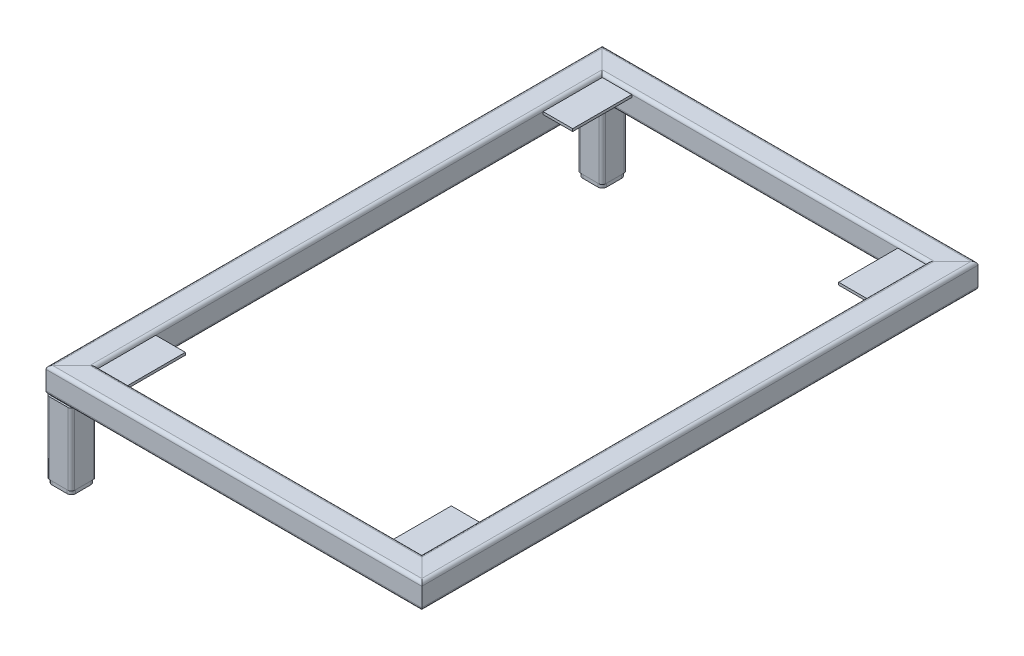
SolidWorks part; units mm, degrees
ref_plane "Plan de face" through (0, 0, 0) normal (0, 0, 1) x (1, 0, 0)
ref_plane "Plan de dessus" through (0, 0, 0) normal (0, 1, 0) x (1, 0, 0)
ref_plane "Plan de droite" through (0, 0, 0) normal (1, 0, 0) x (0, 0, -1)
sketch3d "Esquisse3D2"
  line L2 (-7.8466, -369.5842, 131.2649) -> (-7.8466, -369.5842, 760)
  line L4 (407.1534, -369.5842, 760) -> (407.1534, -369.5842, 131.2649)
  line L5 (-7.8466, -369.5842, 131.2649) -> (-7.8466, -469.5842, 131.2649)
  line L15 (407.1534, -369.5842, 760) -> (-7.8466, -369.5842, 760)
  line L17 (-7.8466, -369.5842, 131.2649) -> (407.1534, -369.5842, 131.2649)
  line L18 (-7.8466, -369.5842, 760) -> (-7.8466, -469.5842, 760)
  dimension "D2" = 415
  dimension "D4" = 415
  dimension "D5" = 100
  dimension "D10" = 100
other "Elément mécano-soudé1"
ref_plane "Plan1" through (407.1534, -369.5842, 760) normal (0, 0, -1) x (1, 0, 0)
sketch "Sketch1" plane through (407.1534, -369.5842, 760) normal (0, 0, -1) x (1, 0, 0)
  line L0 (-11, -13) -> (11, -13)
  line L1 (-13, -11) -> (-13, 11)
  line L2 (11, 13) -> (-11, 13)
  line L3 (13, 11) -> (13, -11)
  line L4 (-11, -15) -> (11, -15)
  line L5 (-15, -11) -> (-15, 11)
  line L6 (11, 15) -> (-11, 15)
  line L7 (15, 11) -> (15, -11)
  line L8 (-15, 0) -> (-13, 0) construction
  line L9 (-13, 0) -> (13, 0) construction
  line L10 (13, 0) -> (15, 0) construction
  line L12 (0, 15) -> (0, 13) construction
  line L13 (0, 13) -> (0, -13) construction
  line L14 (0, -13) -> (0, -15) construction
  arc A0 (15, 11) -> (11, 15) centre (11, 11) ccw
  arc A1 (11, -15) -> (15, -11) centre (11, -11) ccw
  arc A2 (-15, -11) -> (-11, -15) centre (-11, -11) ccw
  arc A3 (-11, 15) -> (-15, 11) centre (-11, 11) ccw
  arc A4 (-11, 13) -> (-13, 11) centre (-11, 11) ccw
  arc A5 (13, 11) -> (11, 13) centre (11, 11) ccw
  arc A6 (11, -13) -> (13, -11) centre (11, -11) ccw
  arc A7 (-13, -11) -> (-11, -13) centre (-11, -11) ccw
  point P2 (-15, 15)
  point P33 (-15, -15)
  point P34 (15, -15)
  point P36 (15, 15)
  point P37 (0, 0)
  dimension "D1" = 4
  dimension "Thickness" = 2
  dimension "V_leg" = 30
  dimension "H_leg" = 30
other "Embout1" parameters "D1"=5, "D2"=3, "D3"=3
fillet "Congé1" radius 5 4 edges at (6.1534, -472.0842, 746) (-21.8466, -472.0842, 746) (-21.8466, -472.0842, 774) (6.1534, -472.0842, 774)
fillet "Congé2" radius 5 4 edges at (6.1534, -472.0842, 117.2649) (-21.8466, -472.0842, 117.2649) (-21.8466, -472.0842, 145.2649) (6.1534, -472.0842, 145.2649)
sketch "Esquisse1" plane through (0, -474.5842, 0) normal (0, -1, 0) x (1, 0, 0)
  line L0 (1.1534, 145.2649) -> (-16.8466, 145.2649) construction
  line L1 (-21.8466, 140.2649) -> (-21.8466, 122.2649) construction
  line L2 (1.1534, 774) -> (-16.8466, 774) construction
  line L3 (-21.8466, 769) -> (-21.8466, 751) construction
  point P0 (-8.1466, 760.3)
  point P1 (-8.1466, 131.5649)
  dimension "D1" = 13.7
  dimension "D2" = 13.7
  dimension "D3" = 13.7
  dimension "D4" = 13.7
hole_wizard "Dégagement 1" positions "Esquisse3D3" profile "Esquisse2" hole size "M12" standard "ISO"
sketch3d "Esquisse3D3"
  point P0 (-8.1466, -474.5842, 760.3)
  point P3 (-8.1466, -474.5842, 131.5649)
sketch "Esquisse2" plane through (-8.1466, -474.5842, 760.3) normal (1, 0, 0) x (0, 0, -1)
  line L0 (0, 0) -> (0, 14.0558)
  line L1 (0, 14.0558) -> (6.75, 10)
  line L2 (6.75, 10) -> (6.75, 0)
  line L5 (6.75, 0) -> (0, 0)
  line L10 (0, 14.0558) -> (-6.75, 10) construction
  line L11 (0, -6.35) -> (0, 107.95) construction
  dimension "Diamètre du perçage" = 13.5
  dimension "Profondeur du perçage" = 10
  dimension "Angle de pointe" = 118
sketch "Esquisse3" plane through (0, 0, 146.2649) normal (0, 0, 1) x (1, 0, 0)
  line L1 (392.1534, -358.5842) -> (357.1534, -358.5842)
  line L2 (392.1534, -358.5842) -> (392.1534, -361.5842)
  line L3 (392.1534, -361.5842) -> (357.1534, -361.5842)
  line L4 (357.1534, -358.5842) -> (357.1534, -361.5842)
  dimension "D1" = 3
  dimension "D2" = 35
extrude "Extrusion1" add sketch "Esquisse3" along normal blind 70 separate body
sketch "Esquisse4" plane through (0, 0, 745) normal (0, 0, -1) x (-1, 0, 0)
  line L1 (-392.1534, -358.5842) -> (-357.1534, -358.5842)
  line L2 (-392.1534, -358.5842) -> (-392.1534, -361.5842)
  line L3 (-392.1534, -361.5842) -> (-357.1534, -361.5842)
  line L4 (-357.1534, -358.5842) -> (-357.1534, -361.5842)
  dimension "D1" = 3
  dimension "D2" = 35
extrude "Extrusion2" add sketch "Esquisse4" along normal blind 70 separate body
sketch "Esquisse5" [suppressed] plane through (0, -359.7842, 0) normal (0, 1, 0) x (-1, 0, 0)
  line L0 (-392.1534, 216.2649) -> (-357.1534, 216.2649) construction
  line L1 (-392.1534, 216.2649) -> (-392.1534, 146.2649) construction
  line L2 (-357.1534, 675) -> (-392.1534, 675) construction
  point P0 (-371.6534, 197.2649)
  point P5 (-371.6534, 694)
  dimension "D1" = 19
  dimension "D2" = 20.5
  dimension "D3" = 19
hole_wizard "Dégagement M102" positions "Esquisse3D4" profile "Esquisse6" hole size "M10" standard "ISO"
sketch3d "Esquisse3D4" [suppressed]
  point P0 (371.6534, -359.7842, 197.2649)
  point P3 (371.6534, -359.7842, 694)
sketch "Esquisse6" plane through (371.6534, -359.7842, 197.2649) normal (1, 0, 0) x (0, 0, 1)
  line L0 (0, 0) -> (0, 13.3047)
  line L1 (0, 13.3047) -> (5.5, 10)
  line L2 (5.5, 10) -> (5.5, 0)
  line L5 (5.5, 0) -> (0, 0)
  line L10 (0, 13.3047) -> (-5.5, 10) construction
  line L11 (0, -6.35) -> (0, 107.95) construction
  dimension "Diamètre du perçage" = 11
  dimension "Profondeur du perçage" = 10
  dimension "Angle de pointe" = 118
sketch "Esquisse7" plane through (0, 0, 146.2649) normal (0, 0, 1) x (1, 0, 0)
  line L1 (7.1534, -358.5842) -> (42.1534, -358.5842)
  line L2 (7.1534, -358.5842) -> (7.1534, -361.5842)
  line L3 (7.1534, -361.5842) -> (42.1534, -361.5842)
  line L4 (42.1534, -358.5842) -> (42.1534, -361.5842)
  dimension "D1" = 35
  dimension "D2" = 3
extrude "Extrusion3" add sketch "Esquisse7" along normal blind 70 separate body
sketch "Esquisse8" plane through (0, 0, 745) normal (0, 0, -1) x (-1, 0, 0)
  line L1 (-7.1534, -358.5842) -> (-42.1534, -358.5842)
  line L2 (-7.1534, -358.5842) -> (-7.1534, -361.5842)
  line L3 (-7.1534, -361.5842) -> (-42.1534, -361.5842)
  line L4 (-42.1534, -358.5842) -> (-42.1534, -361.5842)
  dimension "D1" = 35
  dimension "D2" = 3
extrude "Extrusion4" add sketch "Esquisse8" along normal blind 70 separate body
sketch "Esquisse9" [suppressed] plane through (0, -359.7842, 0) normal (0, 1, 0) x (-1, 0, 0)
  line L0 (-42.1534, 146.2649) -> (-7.1534, 146.2649) construction
  line L1 (-7.1534, 216.2649) -> (-7.1534, 146.2649) construction
  line L2 (-392.1534, 745) -> (-7.1534, 745) construction
  line L3 (-7.1534, 675) -> (-7.1534, 745) construction
  point P0 (-27.6534, 197.2649)
  point P1 (-27.6534, 694)
  dimension "D1" = 51
  dimension "D2" = 20.5
  dimension "D3" = 51
  dimension "D4" = 20.5
hole_wizard "Dégagement M103" positions "Esquisse3D5" profile "Esquisse10" hole size "M10" standard "ISO"
sketch3d "Esquisse3D5" [suppressed]
  point P0 (27.6534, -359.7842, 197.2649)
  point P3 (27.6534, -359.7842, 694)
sketch "Esquisse10" [suppressed] plane through (27.6534, -359.7842, 197.2649) normal (1, 0, 0) x (0, 0, 1)
  line L0 (0, 0) -> (0, 33.3047)
  line L1 (0, 33.3047) -> (5.5, 30)
  line L2 (5.5, 30) -> (5.5, 0)
  line L5 (5.5, 0) -> (0, 0)
  line L10 (0, 33.3047) -> (-5.5, 30) construction
  line L11 (0, -6.35) -> (0, 107.95) construction
  dimension "Diamètre du perçage" = 11
  dimension "Profondeur du perçage" = 30
  dimension "Angle de pointe" = 118
